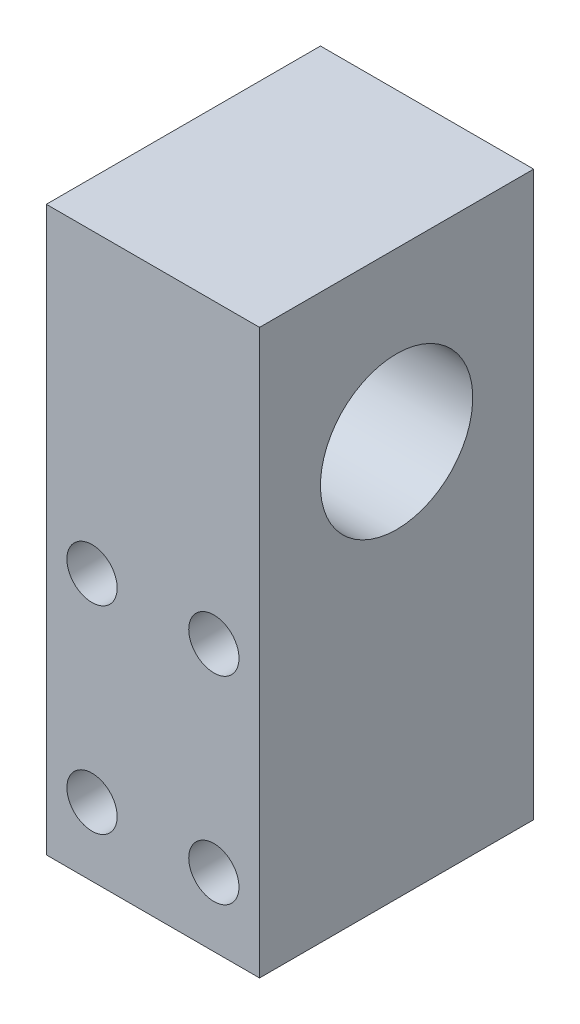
SolidWorks part; units mm, degrees
ref_plane "前视基准面" through (0, 0, 0) normal (0, 0, 1) x (1, 0, 0)
ref_plane "上视基准面" through (0, 0, 0) normal (0, 1, 0) x (1, 0, 0)
ref_plane "右视基准面" through (0, 0, 0) normal (1, 0, 0) x (0, 0, -1)
other "Configuration Table"
sketch "草图1" plane through (0, 0, 0) normal (0, 0, 1) x (1, 0, 0)
  line L1 (-7, 18.5) -> (7, 18.5)
  line L2 (-7, 18.5) -> (-7, -18.5)
  line L3 (-7, -18.5) -> (7, -18.5)
  line L4 (7, 18.5) -> (7, -18.5)
  line L5 (-7, 18.5) -> (7, -18.5) construction
  line L6 (-7, -18.5) -> (7, 18.5) construction
  point P0 (0, 0)
  dimension "D1" = 14
  dimension "D2" = 37
extrude "凸台-拉伸1" add sketch "草图1" along normal blind 18
sketch "草图2" plane through (7, 0, 0) normal (1, 0, 0) x (0, 0, -1)
  line L0 (0, 0) -> (-21.8318, 0) construction
  line L1 (-9, 0) -> (-9, 12.2731) construction
  line L3 (-18, 18.5) -> (0, 18.5) construction
  circle A0 centre (-9, 7.5) radius 5
  dimension "D1" = 10
  dimension "D2" = 11
extrude "切除-拉伸1" cut sketch "草图2" against normal blind 18
hole_wizard "M4 螺纹孔2" positions "草图4" profile "草图5" tap size "M4" standard "DIN"
sketch "草图4" plane through (0, 0, 0) normal (0, 0, -1) x (-1, 0, 0)
  line L0 (7, 18.5) -> (7, -18.5) construction
  line L1 (-7, -18.5) -> (-7, 18.5) construction
  line L2 (7, -18.5) -> (-7, -18.5) construction
  point P0 (-4, -1)
  point P2 (4, -1)
  point P4 (-4, -14)
  point P6 (4, -14)
  dimension "D1" = 8
  dimension "D2" = 3
  dimension "D3" = 3
  dimension "D4" = 3
  dimension "D5" = 4.5
  dimension "D6" = 13
  dimension "D7" = 13
  dimension "D8" = 4.5
sketch "草图5" plane through (4, -1, 0) normal (1, 0, 0) x (0, 1, 0)
  line L0 (0, 0) -> (0, 18)
  line L1 (0, 18) -> (1.65, 18)
  line L2 (1.65, 18) -> (1.65, 0)
  line L5 (1.65, 0) -> (0, 0)
  line L11 (0, -6.35) -> (0, 107.95) construction
  dimension "通孔螺纹孔钻头直径" = 3.3
  dimension "通孔螺纹孔钻头深度" = 18
